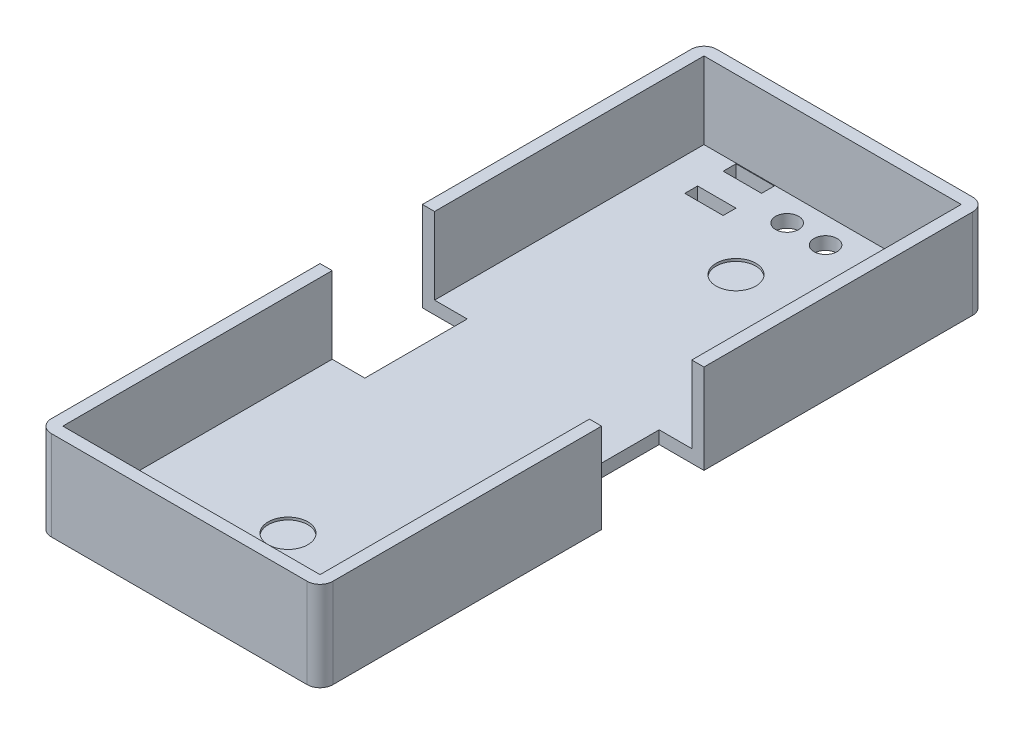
SolidWorks part; units mm, degrees
ref_plane "Front Plane" through (0, 0, 0) normal (0, 0, 1) x (1, 0, 0)
ref_plane "Top Plane" through (0, 0, 0) normal (0, 1, 0) x (1, 0, 0)
ref_plane "Right Plane" through (0, 0, 0) normal (1, 0, 0) x (0, 0, -1)
sketch "Sketch1" plane through (0, 0, 0) normal (0, 1, 0) x (1, 0, 0)
  line L1 (-11, -26) -> (11, -26)
  line L2 (-11, -26) -> (-11, 26)
  line L3 (-11, 26) -> (11, 26)
  line L4 (11, -26) -> (11, 26)
  line L5 (-11, -26) -> (11, 26) construction
  line L6 (-11, 26) -> (11, -26) construction
  point P0 (0, 0)
  dimension "D1" = 52
  dimension "D2" = 22
extrude "Boss-Extrude1" add sketch "Sketch1" along normal blind 7
sketch "Sketch2" plane through (0, 7, 0) normal (0, 1, 0) x (1, 0, 0)
  line L0 (-11, -26) -> (11, -26) construction
  line L1 (-10.05, -25.05) -> (10.05, -25.05)
  line L2 (-10.05, -25.05) -> (-10.05, 25.05)
  line L3 (-10.05, 25.05) -> (10.05, 25.05)
  line L4 (10.05, -25.05) -> (10.05, 25.05)
  line L5 (-10.05, -25.05) -> (10.05, 25.05) construction
  line L6 (-10.05, 25.05) -> (10.05, -25.05) construction
  line L8 (11, -26) -> (11, 26) construction
  point P0 (0, 0)
  dimension "D1" = 0.95
  dimension "D2" = 0.95
extrude "Cut-Extrude1" cut sketch "Sketch2" against normal blind 6
fillet "Fillet1" radius 1 4 edges at (-11, 3.5, 26) (11, 3.5, 26) (11, 3.5, -26) (-11, 3.5, -26)
sketch "Sketch3" plane through (0, 0, 0) normal (0, -1, 0) x (1, 0, 0)
  line L0 (0, -25) -> (0, 25) construction
  line L1 (-10, 0) -> (10, 0) construction
  line L2 (11, 25) -> (11, -25) construction
  line L3 (-11, -25) -> (-11, 25) construction
  line L4 (-10, 26) -> (10, 26) construction
  line L5 (10, -26) -> (-10, -26) construction
  line L6 (0, -23) -> (-10, -23) construction
  line L7 (-4.5, -25) -> (-7.5, -24) construction
  line L8 (-4.5, -25) -> (-7.5, -25)
  line L9 (-4.5, -25) -> (-4.5, -24)
  line L10 (-4.5, -24) -> (-7.5, -24)
  line L11 (-7.5, -25) -> (-7.5, -24)
  line L13 (-4.5, -22) -> (-7.5, -22)
  line L14 (-4.5, -21) -> (-4.5, -22)
  line L15 (-4.5, -21) -> (-7.5, -21)
  line L16 (-7.5, -21) -> (-7.5, -22)
  line L17 (4.5, -21) -> (7.5, -21)
  line L18 (7.5, -21) -> (7.5, -22)
  line L19 (4.5, -22) -> (7.5, -22)
  line L20 (4.5, -21) -> (4.5, -22)
  line L21 (4.5, -25) -> (4.5, -24)
  line L22 (4.5, -25) -> (7.5, -25)
  line L23 (7.5, -25) -> (7.5, -24)
  line L24 (4.5, -24) -> (7.5, -24)
  circle A0 centre (-1.5, -23) radius 0.9
  circle A1 centre (1.5, -23) radius 0.9
  point P21 (-6, -24.5)
  dimension "D7" = 1.8
  dimension "D1" = 1
  dimension "D2" = 1
  dimension "D3" = 1
  dimension "D4" = 1
  dimension "D5" = 2
  dimension "D6" = 1.5
  dimension "D8" = 3
  dimension "D9" = 1
  dimension "D10" = 6
extrude "Cut-Extrude2" cut sketch "Sketch3" against normal blind 3
sketch "Sketch4" plane through (0, 0, 0) normal (0, -1, 0) x (1, 0, 0)
  line L0 (0, -25) -> (0, 25) construction
  line L1 (10, 0) -> (-10, 0) construction
  line L2 (11, 25) -> (11, -25) construction
  line L3 (-11, -25) -> (-11, 25) construction
  line L4 (10, -26) -> (-10, -26) construction
  line L5 (-10, 26) -> (10, 26) construction
  line L6 (-7.5, -4) -> (-7.5, 4)
  line L7 (-7.5, -4) -> (-11, -4)
  line L8 (-11, -4) -> (-11, 4)
  line L9 (-11, 4) -> (-7.5, 4)
  line L10 (11, -4) -> (11, 4)
  line L11 (11, 4) -> (7.5, 4)
  line L12 (7.5, -4) -> (7.5, 4)
  line L13 (7.5, -4) -> (11, -4)
  point P15 (-7.5, 0)
  dimension "D1" = 1
  dimension "D2" = 1
  dimension "D3" = 1
  dimension "D4" = 1
  dimension "D5" = 3.5
  dimension "D6" = 8
extrude "Cut-Extrude3" cut sketch "Sketch4" against normal through all
sketch "Sketch5" plane through (0, 1, 0) normal (0, 1, 0) x (1, 0, 0)
  line L0 (-7.5, 0) -> (7.5, 0) construction
  line L1 (-7.5, 4) -> (-7.5, -4) construction
  line L2 (7.5, -4) -> (7.5, 4) construction
  circle A0 centre (0, 17.5) radius 1.55
  circle A1 centre (0, -17.5) radius 1.55
  dimension "D1" = 3.1
  dimension "D2" = 17.5
extrude "Cut-Extrude4" cut sketch "Sketch5" against normal blind 0.2
